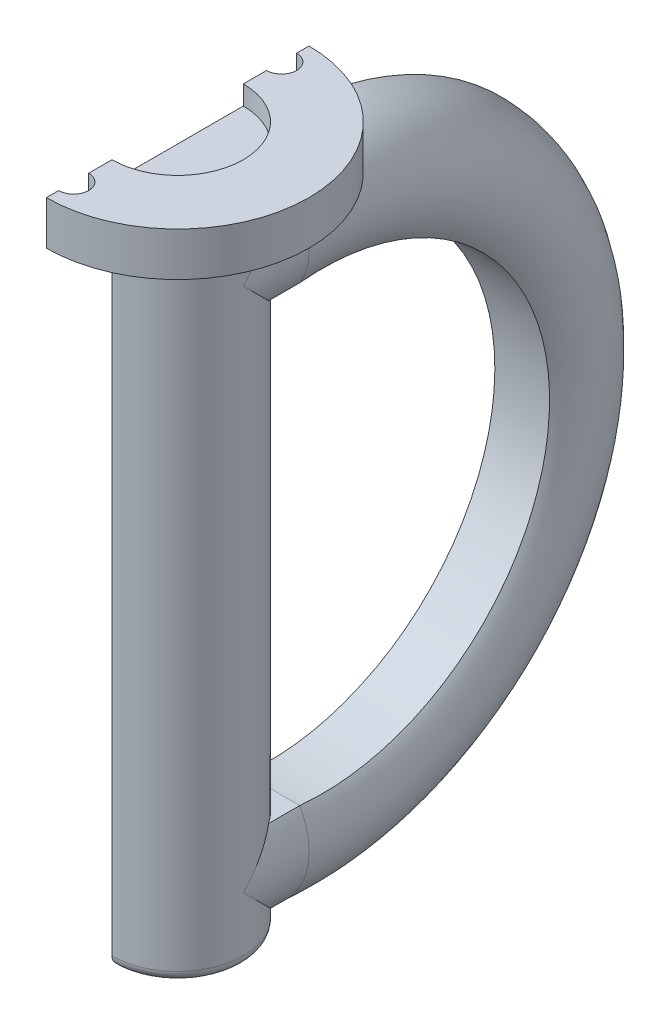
SolidWorks part; units mm, degrees
ref_plane "Front Plane" through (0, 0, 0) normal (0, 0, 1) x (1, 0, 0)
ref_plane "Top Plane" through (0, 0, 0) normal (0, 1, 0) x (1, 0, 0)
ref_plane "Right Plane" through (0, 0, 0) normal (1, 0, 0) x (0, 0, -1)
sketch "Sketch1" plane through (0, 0, 0) normal (0, 1, 0) x (1, 0, 0)
  circle A0 centre (0, 0) radius 24
  dimension "D1" = 48
extrude "Boss-Extrude1" add sketch "Sketch1" along normal blind 8
sketch "Sketch12" plane through (0, 0, 0) normal (0, 0, 1) x (1, 0, 0)
  line L0 (0, 0) -> (0, -120)
  line L1 (0, -120) -> (12, -120)
  line L2 (12, -120) -> (12, 0)
  line L3 (-24, 0) -> (24, 0) construction
  line L4 (12, 0) -> (0, 0)
  line L5 (0, 0) -> (0.3914, 0.2819)
  dimension "D1" = 12
  dimension "D2" = 120
revolve "Revolve4" add sketch "Sketch12" angle 360 about L0
sketch "Sketch13" plane through (0, 0, 0) normal (0, 0, 1) x (1, 0, 0)
  line L0 (-10, -18.6332) -> (10, -18.6332)
  arc A0 (10, -18.6332) -> (-10, -18.6332) centre (0, -12) ccw
  dimension "D1" = 24
  dimension "D2" = 20
sketch "Sketch14" plane through (0, 0, 0) normal (1, 0, 0) x (0, 0, -1)
  line L2 (0, -108) -> (12, -108)
  line L3 (0, -12) -> (12, -12)
  arc A0 (12, -108) -> (12, -12) centre (16.4021, -60) ccw
  dimension "D2" = 12
  dimension "D3" = 12
sweep "Sweep1" add profiles "Sketch13" path "Sketch14"
sketch "Sketch15" plane through (0, -120, 0) normal (0, -1, 0) x (1, 0, 0)
  line L0 (0, 0) -> (0, -90.1747)
  line L1 (0, 36.1347) -> (-34.967, 36.1347)
  line L2 (-34.967, 36.1347) -> (-34.967, -90.1747)
  line L3 (-34.967, -90.1747) -> (0, -90.1747)
  line L4 (0, 36.1347) -> (0, 0)
extrude "Cut-Extrude9" cut sketch "Sketch15" against normal through all
sketch "Sketch16" plane through (0, -120, 0) normal (0, 1, 0) x (1, 0, 0)
  line L0 (0, 11.4509) -> (0, 21.3994)
  line L1 (0, 21.3994) -> (0, 23.7276)
  line L2 (0, 23.7276) -> (-3.8367, 23.7276)
  line L3 (-3.8367, 23.7276) -> (-3.8367, 8.9693)
  line L4 (-3.8367, 8.9693) -> (0, 8.9693)
  line L5 (0, 24) -> (0, -24) construction
  line L6 (0, 8.9693) -> (0, 11.4509)
extrude "Cut-Extrude10" cut sketch "Sketch16" against normal blind 10
sketch "Sketch17" plane through (0, 0, 0) normal (-1, 0, 0) x (0, 0, 1)
  line L0 (-5.5, -101.3668) -> (5.5, -101.3668)
  line L5 (-61.7703, -65.5) -> (-61.7703, -54.5)
  line L6 (-61.7703, -54.5) -> (-72.7703, -54.5)
  line L7 (-72.7703, -54.5) -> (-72.7703, -65.5)
  line L8 (-72.7703, -65.5) -> (-61.7703, -65.5)
  line L14 (5.5, -101.3668) -> (5.5, -90.3668)
  line L15 (5.5, -90.3668) -> (-5.5, -90.3668)
  line L16 (-5.5, -90.3668) -> (-5.5, -101.3668)
  line L17 (-5.5, -18.6332) -> (5.5, -18.6332)
  line L18 (5.5, -18.6332) -> (5.5, -29.6332)
  line L19 (5.5, -29.6332) -> (-5.5, -29.6332)
  line L20 (-5.5, -29.6332) -> (-5.5, -18.6332)
  dimension "D2" = 11
  dimension "D3" = 11
  dimension "D6" = 11
  dimension "D7" = 11
  dimension "D9" = 11
  dimension "D10" = 11
extrude "Cut-Extrude11" cut sketch "Sketch17" against normal blind 5.5
fillet "Fillet1" radius 2 1 edges at (11.9891, -120, 0.512)
sketch "Sketch18" plane through (0, 8, 0) normal (0, 1, 0) x (1, 0, 0)
  circle A0 centre (0, 0) radius 12
  dimension "D1" = 24
extrude "Cut-Extrude12" cut sketch "Sketch18" against normal blind 3.5
sketch "Sketch19" plane through (0, 8, 0) normal (0, 1, 0) x (1, 0, 0)
  line L2 (0, 24) -> (0, 12) construction
  line L3 (0, -12) -> (0, -24) construction
  circle A0 centre (0, 19) radius 2.75
  circle A1 centre (0, -19) radius 2.75
  dimension "D1" = 5.5
  dimension "D2" = 5.5
  dimension "D3" = 19
  dimension "D4" = 19
extrude "Cut-Extrude13" cut sketch "Sketch19" against normal blind 5.5
